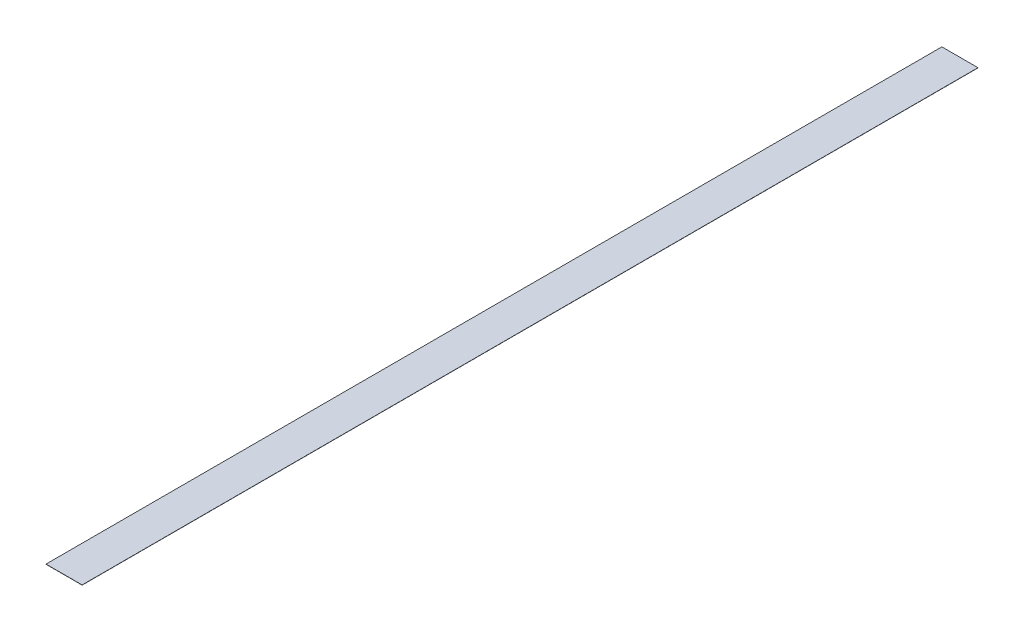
SolidWorks part; units mm, degrees
ref_plane "Front Plane" through (0, 0, 0) normal (0, 0, 1) x (1, 0, 0)
ref_plane "Top Plane" through (0, 0, 0) normal (0, 1, 0) x (1, 0, 0)
ref_plane "Right Plane" through (0, 0, 0) normal (1, 0, 0) x (0, 0, -1)
sketch "Sketch1" plane through (0, 0, 0) normal (0, 1, 0) x (1, 0, 0)
  line L0 (-55, 0) -> (55, 0) construction
  line L1 (0, -55) -> (0, 55) construction
  line L5 (23.8125, -590.55) -> (-23.8125, -590.55)
  line L6 (23.8125, -590.55) -> (23.8125, 590.55)
  line L7 (23.8125, 590.55) -> (-23.8125, 590.55)
  line L8 (-23.8125, -590.55) -> (-23.8125, 590.55)
  point P2 (23.8125, 0)
  point P9 (0, -590.55)
  dimension "D1" = 1181.1
  dimension "D2" = 47.625
extrude "Boss-Extrude1" add sketch "Sketch1" along normal blind 0.254
